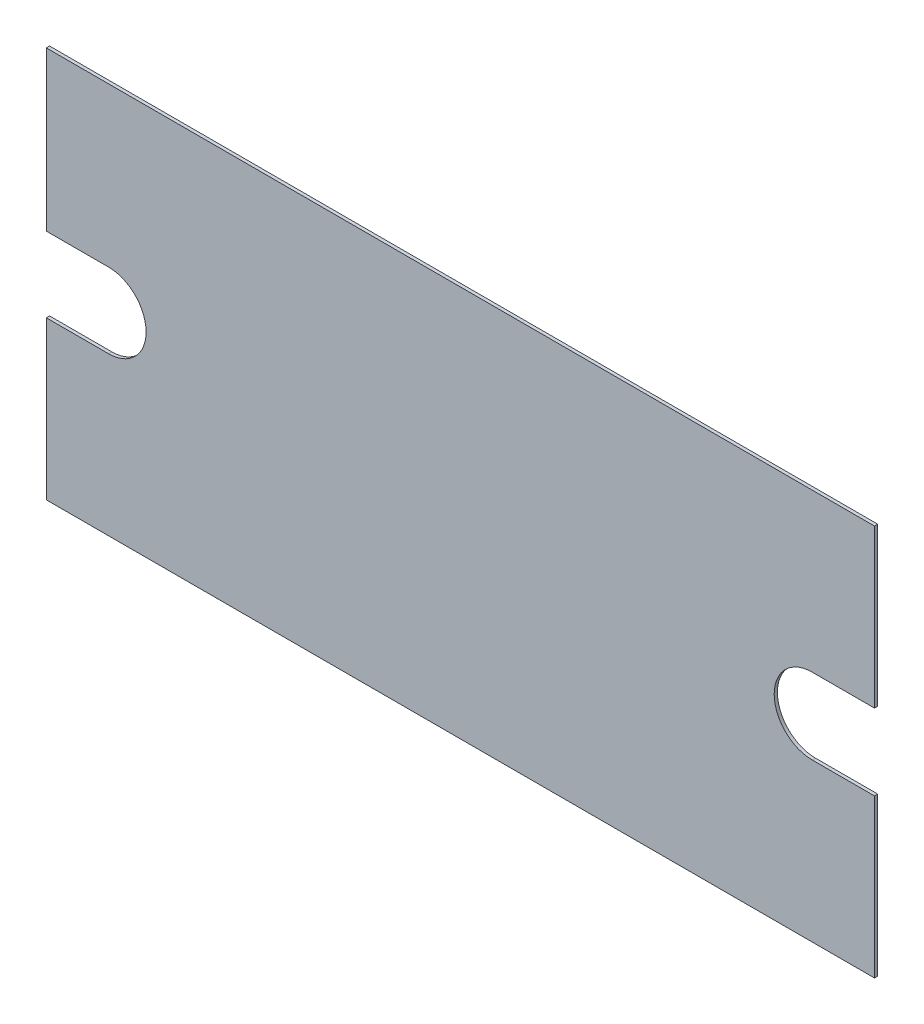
SolidWorks part; units mm, degrees
ref_plane "Přední rovina" through (0, 0, 0) normal (0, 0, 1) x (1, 0, 0)
ref_plane "Horní rovina" through (0, 0, 0) normal (0, 1, 0) x (1, 0, 0)
ref_plane "Pravá rovina" through (0, 0, 0) normal (1, 0, 0) x (0, 0, -1)
sketch "Skica1" plane through (0, 0, 0) normal (0, 0, 1) x (1, 0, 0)
  line L0 (-24.2674, 20.78) -> (16.4598, 20.78)
  line L1 (16.4598, 20.78) -> (16.4598, 11.03)
  line L2 (-24.2674, 20.78) -> (-34.7402, 20.78)
  line L3 (-34.7402, 6.33) -> (-30.8902, 6.33)
  line L4 (16.4598, 6.33) -> (16.4598, -3.42)
  line L5 (16.4598, -3.42) -> (-34.7402, -3.42)
  line L6 (-34.7402, -3.42) -> (-34.7402, 6.33)
  line L7 (-34.7402, 10.9687) -> (-30.8902, 10.9687)
  line L8 (16.4598, 11.03) -> (12.6098, 11.03)
  line L9 (-34.7402, 10.9687) -> (-34.7402, 20.7187)
  line L10 (16.4598, 6.33) -> (12.6098, 6.33)
  line L11 (-34.7402, 20.7187) -> (-34.7402, 20.78)
  line L12 (12.6098, 11.03) -> (12.6098, 6.33) construction
  line L13 (-30.8902, 10.9687) -> (-30.8902, 6.33) construction
  arc A0 (-30.8902, 10.9687) -> (-30.8902, 6.33) centre (-30.8902, 8.6494) cw
  arc A1 (12.6098, 11.03) -> (12.6098, 6.33) centre (12.6098, 8.68) ccw
  dimension "D1" = 51.2
  dimension "D2" = 24.2
  dimension "D3" = 9.75
  dimension "D4" = 9.75
  dimension "D5" = 9.75
  dimension "D6" = 3.85
extrude "Přidat vysunutím1" add sketch "Skica1" along normal blind 0.2
